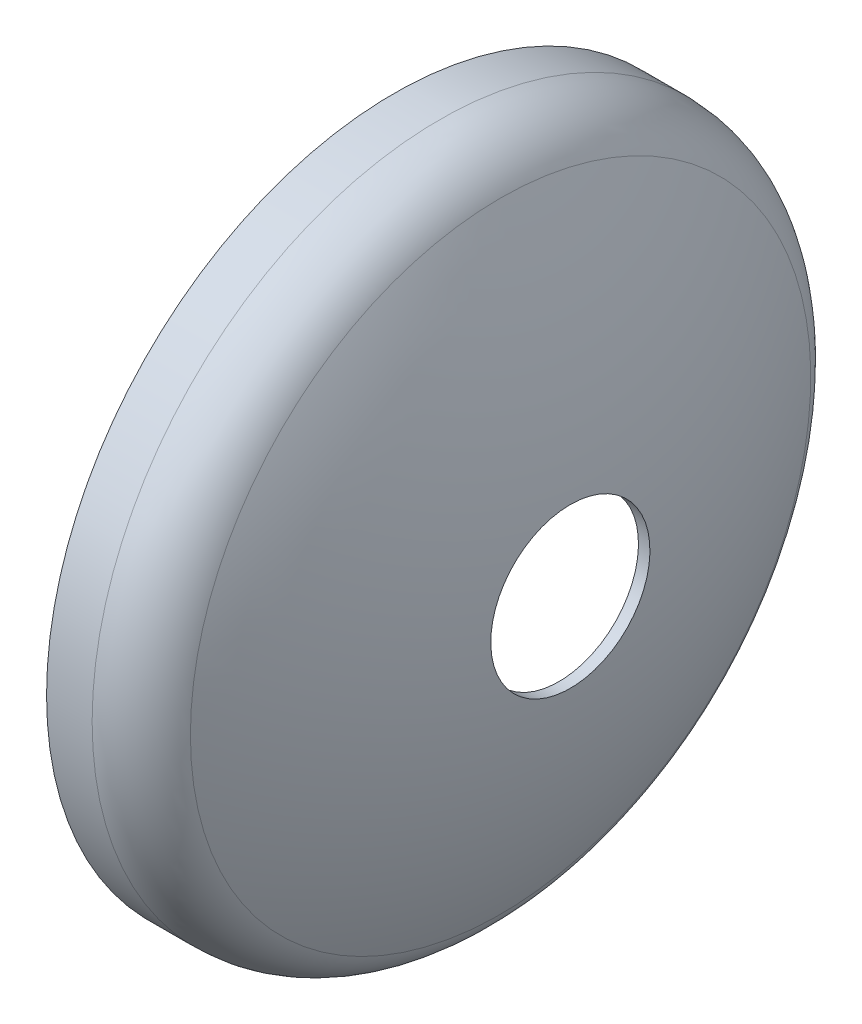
SolidWorks part; units mm, degrees
ref_plane "Plan de face" through (0, 0, 0) normal (0, 0, 1) x (1, 0, 0)
ref_plane "Plan de dessus" through (0, 0, 0) normal (0, 1, 0) x (1, 0, 0)
ref_plane "Plan de droite" through (0, 0, 0) normal (1, 0, 0) x (0, 0, -1)
sketch "Esquisse1" plane through (0, 0, 0) normal (0, 0, 1) x (1, 0, 0)
  line L0 (550, 305) -> (590, 305)
  line L1 (57.1901, 0) -> (1266.8834, 0) construction
  line L2 (550, 295) -> (590, 295)
  line L3 (698.7776, 0) -> (708.7776, 0)
  line L4 (550, -305) -> (550, 305) construction
  line L5 (550, 305) -> (550, 295)
  line L6 (550, -295) -> (550, 295) construction
  arc A0 (590, 305) -> (643.4692, 272.2222) centre (590, 245) cw
  arc A1 (708.7776, 0) -> (643.4692, 272.2222) centre (108.7776, 0) ccw
  arc A2 (698.7776, 0) -> (634.5576, 267.6852) centre (108.7776, 0) ccw
  arc A3 (590, 295) -> (634.5576, 267.6852) centre (590, 245) cw
  dimension "D2" = 60
  dimension "D3" = 600
  dimension "D1" = 40
  dimension "D4" = 10
  dimension "D5" = 610
revolve "Révolution3" add sketch "Esquisse1" angle 360 about L1
sketch "Esquisse2" plane through (0, 0, 0) normal (1, 0, 0) x (0, 0, -1)
  circle A0 centre (0, 0) radius 69.85 construction
  circle A1 centre (0, 0) radius 69.85
extrude "Enlèv. mat.-Extru.1" cut sketch "Esquisse2" along normal blind 1995.4375
